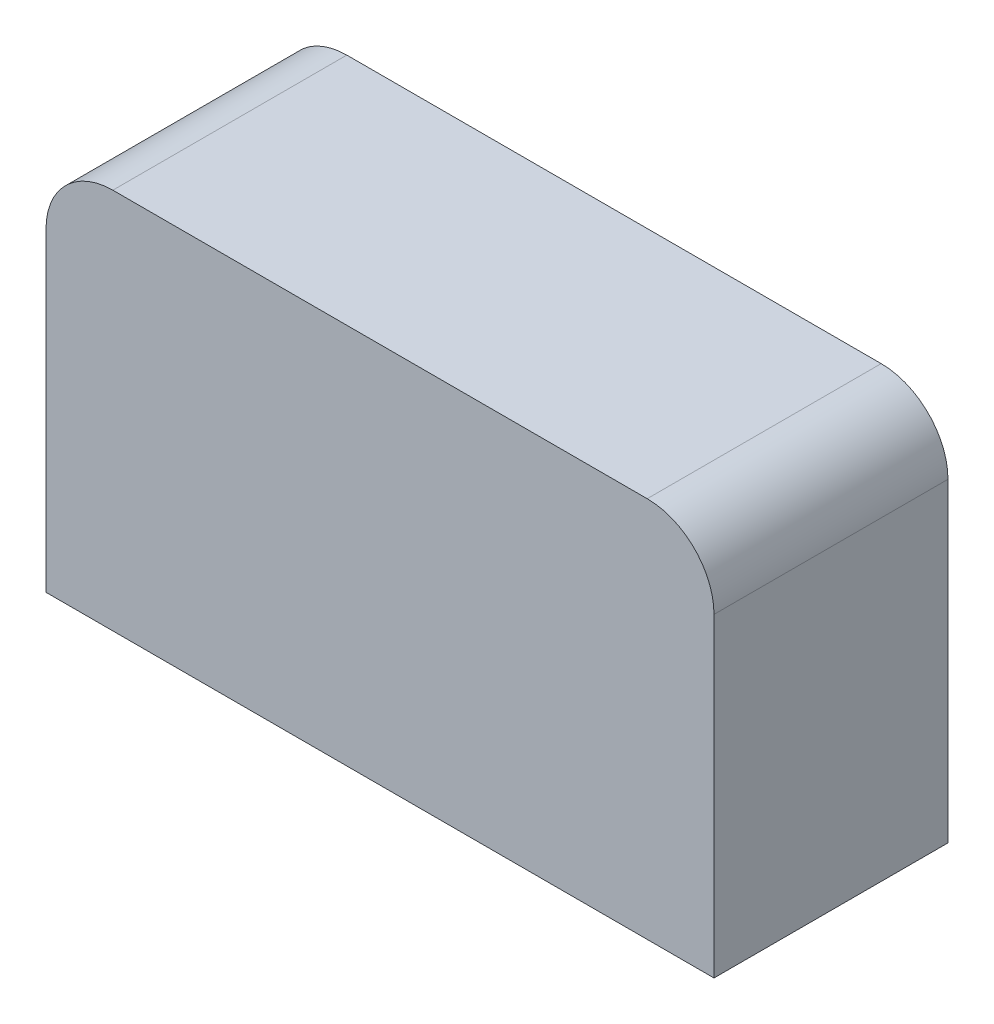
SolidWorks part; units mm, degrees
ref_plane "Front Plane" through (0, 0, 0) normal (0, 0, 1) x (1, 0, 0)
ref_plane "Top Plane" through (0, 0, 0) normal (0, 1, 0) x (1, 0, 0)
ref_plane "Right Plane" through (0, 0, 0) normal (1, 0, 0) x (0, 0, -1)
sketch "Sketch1" plane through (0, 0, 0) normal (0, 0, 1) x (1, 0, 0)
  line L1 (0, 40) -> (70, 40)
  line L2 (0, 40) -> (0, 0)
  line L3 (0, 0) -> (70, 0)
  line L4 (70, 40) -> (70, 0)
  dimension "D1" = 40
  dimension "D2" = 70
extrude "Boss-Extrude1" add sketch "Sketch1" along normal blind 24.52
fillet "Fillet1" radius 7 1 edges at (0, 40, 12.26)
fillet "Fillet2" radius 7 1 edges at (70, 40, 12.26)
sketch "Sketch4" plane through (0, 0, 0) normal (0, 0, -1) x (-1, 0, 0)
  line L4 (0, 0) -> (-70, 0) construction
  line L5 (-53, 36) -> (-17, 36) construction
  line L7 (-53, 36) -> (-17, 36)
  line L8 (-53, 36) -> (-53, 0)
  line L9 (-53, 0) -> (-17, 0)
  line L10 (-17, 36) -> (-17, 0)
  point P7 (-35, 36)
  dimension "D1" = 36
extrude "Cut-Extrude1" cut sketch "Sketch4" against normal blind 20.45
sketch "Sketch7" plane through (0, 0, 0) normal (0, 0, -1) x (-1, 0, 0)
  line L19 (-53, 0) -> (-70, 0) construction
  circle A0 centre (-65.185, 18) radius 3.15
  circle A1 centre (-4.815, 18) radius 3.15
  point P4 (0, 0)
  point P7 (0, 0)
  point P8 (0, 0)
  point P9 (-1.836, 14.9336)
  point P10 (-70, 15.9237)
  point P11 (0, 0)
  point P12 (0, 0)
  point P14 (-70, 16.1066)
  dimension "D2" = 6.3
  dimension "D3" = 60.37
  dimension "D1" = 6.3
  dimension "D4" = 18
extrude "Cut-Extrude2" cut sketch "Sketch7" against normal blind 8
sketch "Sketch15" plane through (0, 0, 0) normal (0, 0, -1) x (-1, 0, 0)
  line L0 (-53, 18) -> (-61.5, 18) construction
  line L1 (-53, 36) -> (-53, 0) construction
  line L2 (-53, 25.5) -> (-53, 10.5) construction
  line L3 (-60.6502, 18.7498) -> (-53, 25.5)
  line L4 (-53, 25.5) -> (-53, 10.5)
  line L5 (-53, 10.5) -> (-60.6502, 17.2502)
  line L6 (-17, 18) -> (-8.5, 18) construction
  line L7 (-17, 0) -> (-17, 36) construction
  line L8 (-17, 25.5) -> (-17, 10.5) construction
  line L9 (-17, 25.5) -> (-9.3498, 18.7498)
  line L10 (-9.3498, 17.2502) -> (-17, 10.5)
  line L11 (-17, 10.5) -> (-17, 25.5)
  arc A0 (-60.6502, 17.2502) -> (-60.6502, 18.7498) centre (-59.9886, 18) cw
  arc A1 (-9.3498, 17.2502) -> (-9.3498, 18.7498) centre (-10.0114, 18) ccw
  point P10 (-53, 18)
  point P16 (-17, 18)
  dimension "D4" = 1
  dimension "D1" = 15
  dimension "D2" = 8.5
  dimension "D3" = 15
extrude "Cut-Extrude6" cut sketch "Sketch15" against normal blind 3
sketch "Sketch16" plane through (0, 0, 20.45) normal (0, 0, -1) x (-1, 0, 0)
  line L0 (-53, 36) -> (-17, 0) construction
  circle A0 centre (-35, 18) radius 3
  dimension "D1" = 6
extrude "Cut-Extrude7" cut sketch "Sketch16" against normal blind 1
